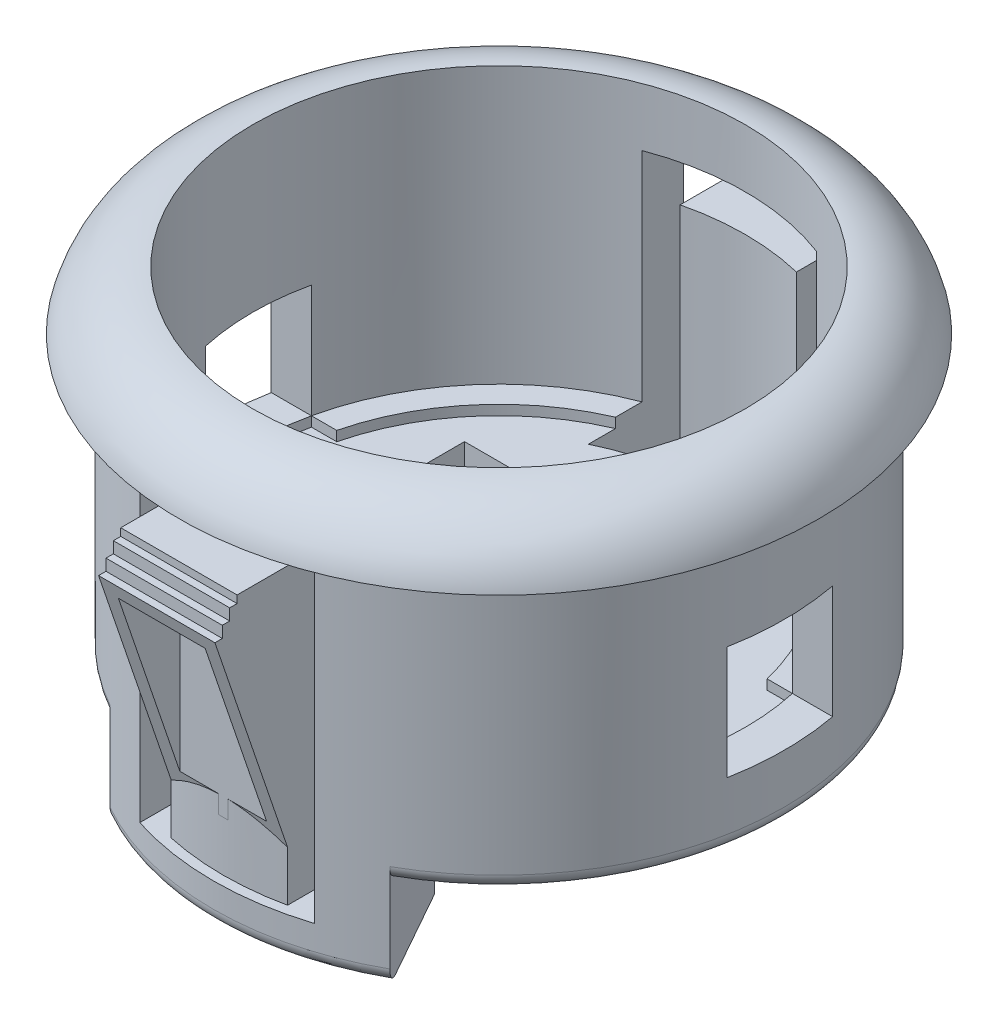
SolidWorks part; units mm, degrees
ref_plane "Front" through (0, 0, 0) normal (0, 0, 1) x (1, 0, 0)
ref_plane "Top" through (0, 0, 0) normal (0, 1, 0) x (1, 0, 0)
ref_plane "Right" through (0, 0, 0) normal (1, 0, 0) x (0, 0, -1)
sketch "Sketch1" plane through (0, 0, 0) normal (0, 0, 1) x (1, 0, 0)
  line L0 (14.732, 0) -> (16.51, 0)
  line L1 (12.7, 3) -> (12.7, -11.224)
  line L2 (12.7, 3) -> (0, 3) construction
  line L3 (14.732, 0) -> (14.732, -19.098)
  line L4 (14.732, -19.098) -> (8.6995, -19.098)
  line L5 (8.6995, -19.098) -> (8.6995, -14.526)
  line L6 (8.6995, -14.526) -> (0, -14.526)
  line L7 (12.7, -11.224) -> (0, -11.224)
  line L8 (0, 3) -> (0, -47.7375) construction
  line L9 (0, -11.224) -> (0, -14.526)
  arc A0 (16.51, 0) -> (12.7, 3) centre (12.7, -0.9194) ccw
  dimension "D1" = 16.51
  dimension "D2" = 3
  dimension "D3" = 17.526
  dimension "D4" = 22.098
  dimension "D5" = 8.6995
  dimension "D6" = 12.7
  dimension "D7" = 14.732
  dimension "D8" = 14.224
  dimension "D9" = 3.81
revolve "Revolve1" add sketch "Sketch1" angle 360 about L8
sketch "Sketch3" plane through (0, -19.098, 0) normal (0, -1, 0) x (1, 0, 0)
  line L0 (-7.2136, -12.8451) -> (7.2136, 12.8451)
  line L1 (-7.2136, 12.8451) -> (7.2136, -12.8451)
  line L2 (0, -14.732) -> (0, 14.732) construction
  line L3 (-7.2136, 12.8451) -> (7.2136, 12.8451) construction
  circle A0 centre (0, 0) radius 14.732 construction
  point P6 (0, 0)
  point P10 (0, 12.8451)
  dimension "D1" = 14.4272
extrude "feet" cut sketch "Sketch3" against normal up to surface (4.572 mm away) contours L1 L0 M2 M1 | L1 L0 M1 M2
sketch "Sketch2" plane through (0, -14.526, 0) normal (0, -1, 0) x (1, 0, 0)
  line L0 (0, 6.0325) -> (0, -6.0325) construction
  line L1 (6.477, 6.0325) -> (-6.477, 6.0325)
  line L2 (6.477, 6.0325) -> (6.477, -6.0325)
  line L3 (6.477, -6.0325) -> (-6.477, -6.0325)
  line L4 (-6.477, 6.0325) -> (-6.477, -6.0325)
  point P6 (0, 0)
  dimension "D1" = 12.065
  dimension "D2" = 12.954
extrude "switch hole" cut sketch "Sketch2" against normal up to next
sketch "Sketch6" plane through (0, 0, 0) normal (1, 0, 0) x (0, 0, -1)
  line L1 (-2.7305, -5.382) -> (2.7305, -5.382)
  line L2 (-2.7305, -5.382) -> (-2.7305, -11.224)
  line L3 (-2.7305, -11.224) -> (2.7305, -11.224)
  line L4 (2.7305, -5.382) -> (2.7305, -11.224)
  line L5 (0, 0) -> (0, -5.382) construction
  line L6 (6.0325, -11.224) -> (-6.0325, -11.224) construction
  dimension "D2" = 5.842
  dimension "D3" = 5.461
extrude "square" cut sketch "Sketch6" against normal through all and the other way through all
sketch "Sketch4" plane through (0, -11.224, 0) normal (0, 1, 0) x (1, 0, 0)
  line L0 (0, 2.7305) -> (12.403, 2.7305)
  line L1 (0, 2.7305) -> (-12.403, 2.7305)
  line L2 (0, -2.7305) -> (12.403, -2.7305)
  line L3 (0, 2.7305) -> (0, -2.7305) construction
  line L4 (0, -2.7305) -> (-12.403, -2.7305)
  line L5 (12.403, -2.7305) -> (14.4767, -2.7305) construction
  circle A0 centre (0, 0) radius 11.43
  circle A2 centre (0, 0) radius 12.7 construction
  circle A3 centre (0, 0) radius 12.7
  point P7 (0, 0)
  dimension "D1" = 1.27
extrude "Extrude3" cut sketch "Sketch4" against normal blind 0.508
sketch "Sketch5" plane through (0, -11.732, 0) normal (0, 1, 0) x (1, 0, 0)
  line L0 (6.477, -6.0325) -> (-6.477, -6.0325) construction
  line L1 (7.8105, 6.0325) -> (-7.8105, 6.0325)
  line L2 (7.8105, 6.0325) -> (7.8105, -6.0325)
  line L3 (7.8105, -6.0325) -> (-7.8105, -6.0325)
  line L4 (-7.8105, 6.0325) -> (-7.8105, -6.0325)
  line L5 (-6.477, 6.0325) -> (6.477, 6.0325) construction
  line L6 (0, 6.0325) -> (0, -6.0325) construction
  point P10 (0, 0)
  dimension "D1" = 15.621
extrude "switch hole2" cut sketch "Sketch5" against normal offset from surface (1.524 mm away) 1.27
sketch "Sketch7" plane through (0, 0, 0) normal (0, -1, 0) x (1, 0, 0)
  line L4 (3, 13.904) -> (3, 12.3406)
  line L5 (0, 0) -> (0, 14.732) construction
  line L6 (4.5, 14.0279) -> (4.5, 9.1091)
  line L7 (-4.5, 9.1091) -> (-4.5, 14.0279)
  line L8 (4.5, 9.1091) -> (-4.5, 9.1091) construction
  line L9 (-3, 13.904) -> (-3, 12.3406)
  circle A2 centre (0, 0) radius 14.732 construction
  circle A3 centre (0, 0) radius 10.16
  circle A4 centre (0, 0) radius 14.732
  arc A5 (-3, 13.904) -> (3, 13.904) centre (0, 0) cw
  circle A6 centre (0, 0) radius 12.7 construction
  circle A7 centre (0, 0) radius 12.7
  point P6 (0, 9.1091)
  point P16 (0, 14.224)
  dimension "D2" = 0.508
  dimension "D1" = 20.32
  dimension "D3" = 9
  dimension "D4" = 6
extrude "tab circ cutout" cut sketch "Sketch7" along normal offset from surface (17.066 mm away) 2.032
sketch "Sketch9" plane through (3, 0, 0) normal (1, 0, 0) x (0, 0, -1)
  line L1 (-12.3406, 0) -> (-14.8806, 0)
  line L2 (-12.3406, 0) -> (-12.3406, -1.905)
  line L3 (-12.3406, -1.905) -> (-14.8806, -1.905)
  line L4 (-14.8806, 0) -> (-14.8806, -1.905)
  dimension "D1" = 1.905
  dimension "D2" = 2.54
extrude "tab top" cut sketch "Sketch9" against normal up to next
sketch "Sketch10" plane through (0, 0, 0) normal (1, 0, 0) x (0, 0, -1)
  line L0 (-13.904, -14.478) -> (-17.6511, -3.4682)
  line L1 (-13.904, -17.066) -> (-13.904, -14.478) construction
  line L2 (-17.6511, -3.4682) -> (-17.2701, -3.4682)
  line L3 (-17.2701, -3.4682) -> (-17.2701, -2.8794)
  line L4 (-17.2701, -2.8794) -> (-16.8891, -2.8794)
  line L5 (-16.8891, -2.8794) -> (-16.8891, -2.2906)
  line L6 (-16.8891, -2.2906) -> (-16.5081, -2.2906)
  line L7 (-16.5081, -2.2906) -> (-16.5081, -1.905)
  line L8 (-16.5081, -1.905) -> (-13.904, -1.905)
  line L9 (-13.904, -1.905) -> (-13.904, -14.478)
  line L10 (0, 0) -> (0, -28.6281) construction
  line L11 (-13.904, -1.905) -> (-12.3406, -1.905) construction
  line L12 (-12.3406, -1.905) -> (-12.7, -1.905) construction
  line L19 (-13.904, -17.066) -> (-14.224, -17.066) construction
  line L20 (-13.904, -17.066) -> (-14.224, -17.066)
  point P11 (-12.5203, -1.905)
  dimension "D1" = 0.381
  dimension "D2" = 5.1308
  dimension "D3" = 12.573
extrude "tab wedge" add sketch "Sketch10" along normal mid plane 6 contours L9 L8 L7 L6 L5 L4 L3 L2 L0
ref_plane "Plane1" through (0, 0, 17.7781) normal (0, 0, 1) x (1, 0, 0)
sketch "Sketch11" plane through (0, 0, 17.7781) normal (0, 0, 1) x (1, 0, 0)
  line L6 (-2.238, -14.478) -> (2.238, -14.478)
  line L9 (2.238, -4.2302) -> (2.238, -14.478)
  line L10 (-2.238, -4.2302) -> (2.238, -4.2302)
  line L11 (-2.238, -14.478) -> (-2.238, -4.2302)
  line L12 (2.238, -4.2302) -> (2.238, -14.478)
  line L13 (-2.238, -4.2302) -> (2.238, -4.2302)
  line L14 (-2.238, -14.478) -> (-2.238, -4.2302)
  dimension "D1" = 0.762
extrude "cut tab" cut sketch "Sketch11" against normal blind 3.556
mirror "tab mirror" about plane through (0, 0, 0) normal (0, 0, 1) of "cut tab", "tab top", "tab wedge", "tab circ cutout"
fillet "Fillet1" radius 0.762 4 edges at (0, -19.098, -14.732) (14.732, -14.526, 0) (0, -19.098, 14.732) (-14.732, -14.526, 0)
